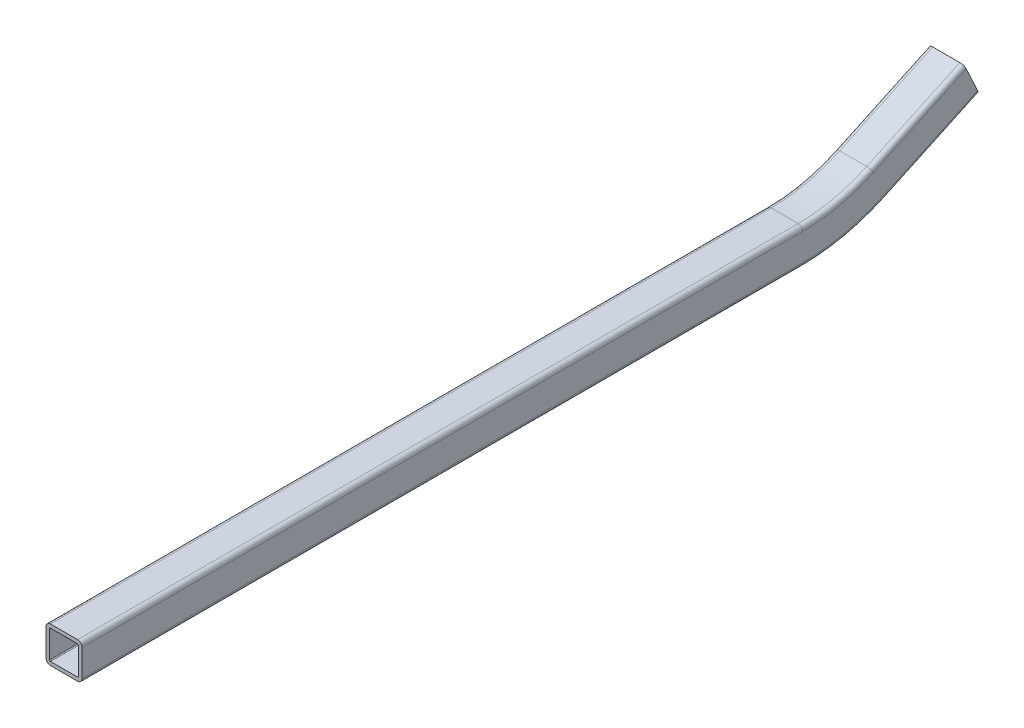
SolidWorks part; units mm, degrees
ref_plane "Plan de face" through (0, 0, 0) normal (0, 0, 1) x (1, 0, 0)
ref_plane "Plan de dessus" through (0, 0, 0) normal (0, 1, 0) x (1, 0, 0)
ref_plane "Plan de droite" through (0, 0, 0) normal (1, 0, 0) x (0, 0, -1)
sketch "Esquisse2" plane through (0, 0, 0) normal (0, 0, 1) x (1, 0, 0)
  line L1 (-7.5, 10) -> (7.5, 10)
  line L2 (-10, 7.5) -> (-10, -7.5)
  line L3 (-7.5, -10) -> (7.5, -10)
  line L4 (10, 7.5) -> (10, -7.5)
  line L5 (-10, 7.5) -> (-10, 10) construction
  line L6 (-10, 10) -> (-7.5, 10) construction
  line L7 (-7.5, 8) -> (7.5, 8)
  line L8 (8, 7.5) -> (8, -7.5)
  line L9 (-7.5, -8) -> (7.5, -8)
  line L10 (-8, 7.5) -> (-8, -7.5)
  line L11 (-7.5, -7.5) -> (7.5, 7.5) construction
  arc A0 (-10, -7.5) -> (-7.5, -10) centre (-7.5, -7.5) ccw
  arc A1 (7.5, -10) -> (10, -7.5) centre (7.5, -7.5) ccw
  arc A2 (7.5, 10) -> (10, 7.5) centre (7.5, 7.5) cw
  arc A3 (-7.5, 10) -> (-10, 7.5) centre (-7.5, 7.5) ccw
  arc A4 (7.5, 8) -> (8, 7.5) centre (7.5, 7.5) cw
  arc A5 (7.5, -8) -> (8, -7.5) centre (7.5, -7.5) ccw
  arc A6 (-8, -7.5) -> (-7.5, -8) centre (-7.5, -7.5) ccw
  arc A7 (-7.5, 8) -> (-8, 7.5) centre (-7.5, 7.5) ccw
  point P4 (0, 0)
  point P14 (-10, 10)
  dimension "D1" = 2.5
  dimension "D2" = 20
  dimension "D3" = 20
  dimension "D4" = 2
sketch "Esquisse3" plane through (0, 0, 0) normal (1, 0, 0) x (0, 0, -1)
  line L0 (0, 0) -> (400, 0)
  line L1 (442.2618, 9.3692) -> (493.9214, 33.4585)
  arc A0 (400, 0) -> (442.2618, 9.3692) centre (400, 100) ccw
  dimension "D3" = 100
  dimension "D1" = 400
  dimension "D2" = 25
  dimension "D4" = 57
sweep "Balayage1" add profiles "Esquisse2" path "Esquisse3"
sketch "Esquisse4" plane through (10, 0, 0) normal (1, 0, 0) x (0, 0, -1)
  line L0 (493.9214, 33.4585) -> (481.2331, 27.5418) construction
  line L1 (497.091, 26.6612) -> (490.7517, 40.2558) construction
  line L2 (438.0356, 18.4323) -> (489.6952, 42.5215) construction
  dimension "D1" = 14
sketch "Esquisse5" plane through (-10, 0, 0) normal (-1, 0, 0) x (0, 0, 1)
  line L0 (-493.9214, 33.4585) -> (-481.2331, 27.5418) construction
  line L1 (-490.7517, 40.2558) -> (-497.091, 26.6612) construction
  line L2 (-438.0356, 18.4323) -> (-489.6952, 42.5215) construction
  dimension "D1" = 14
